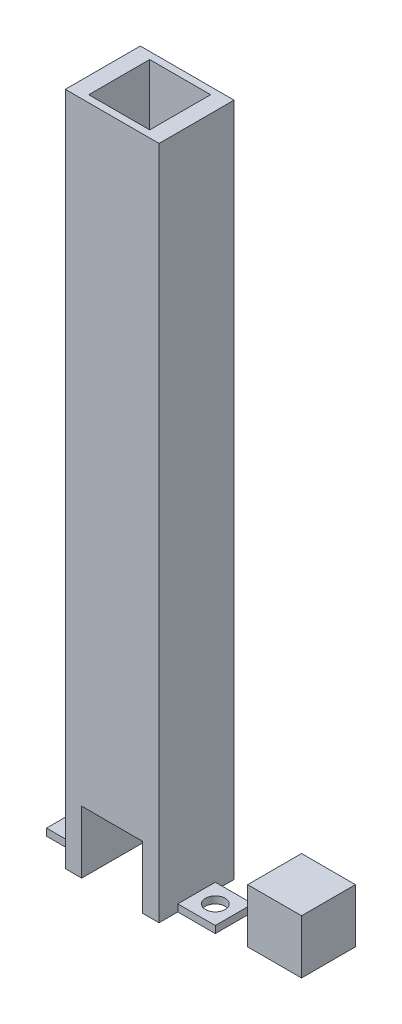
SolidWorks part; units mm, degrees
ref_plane "Front Plane" through (0, 0, 0) normal (0, 0, 1) x (1, 0, 0)
ref_plane "Top Plane" through (0, 0, 0) normal (0, 1, 0) x (1, 0, 0)
ref_plane "Right Plane" through (0, 0, 0) normal (1, 0, 0) x (0, 0, -1)
sketch "Sketch1" plane through (0, 0, 0) normal (0, 0, 1) x (1, 0, 0)
  line L1 (0, 0) -> (-11.5, 0)
  line L2 (0, 0) -> (0, -11.5)
  line L3 (0, -11.5) -> (-11.5, -11.5)
  line L4 (-11.5, 0) -> (-11.5, -11.5)
  dimension "D1" = 11.5
  dimension "D2" = 11.5
extrude "Boss-Extrude1" add sketch "Sketch1" along normal blind 11.5
sketch "Sketch2" plane through (0, 0, 0) normal (0, 0, 1) x (1, 0, 0)
  line L1 (-45.8982, -12) -> (-25.8982, -12)
  line L2 (-45.8982, -12) -> (-45.8982, 132)
  line L3 (-45.8982, 132) -> (-25.8982, 132)
  line L4 (-25.8982, -12) -> (-25.8982, 132)
  dimension "D1" = 20
  dimension "D2" = 144
extrude "Boss-Extrude2" add sketch "Sketch2" along normal blind 16 separate body
sketch "Sketch4" plane through (0, 132, 0) normal (0, 1, 0) x (1, 0, 0)
  line L0 (-25.8982, -16) -> (-25.8982, 0) construction
  line L1 (-42.3982, -1.5) -> (-29.3982, -1.5)
  line L2 (-42.3982, -1.5) -> (-42.3982, -14.5)
  line L3 (-42.3982, -14.5) -> (-29.3982, -14.5)
  line L4 (-29.3982, -1.5) -> (-29.3982, -14.5)
  line L5 (-45.8982, -16) -> (-45.8982, 0) construction
  line L6 (-25.8982, -16) -> (-45.8982, -16) construction
  line L7 (-25.8982, 0) -> (-45.8982, 0) construction
  dimension "D1" = 3.5
  dimension "D2" = 3.5
  dimension "D3" = 1.5
  dimension "D4" = 1.5
extrude "Cut-Extrude1" cut sketch "Sketch4" against normal through all contours L2 L1 L4 L3
sketch "Sketch5" plane through (0, 0, 16) normal (0, 0, 1) x (1, 0, 0)
  line L0 (-25.8982, -12) -> (-25.8982, 132) construction
  line L1 (-29.3982, 1.3) -> (-42.3982, 1.3)
  line L2 (-29.3982, 1.3) -> (-29.3982, -12)
  line L3 (-29.3982, -12) -> (-42.3982, -12)
  line L4 (-42.3982, 1.3) -> (-42.3982, -12)
  line L5 (-45.8982, 132) -> (-45.8982, -12) construction
  line L6 (-45.8982, -12) -> (-25.8982, -12) construction
  dimension "D1" = 3.5
  dimension "D2" = 3.5
  dimension "D3" = 0
  dimension "D4" = 13.3
extrude "Cut-Extrude2" cut sketch "Sketch5" against normal blind 1.5 contours L2 L1 L4 L3
sketch "Sketch6" plane through (0, 0, 0) normal (0, 0, -1) x (-1, 0, 0)
  line L0 (45.8982, -12) -> (25.8982, -12) construction
  line L1 (42.3982, -4) -> (29.3982, -4)
  line L2 (42.3982, -4) -> (42.3982, -12)
  line L3 (42.3982, -12) -> (29.3982, -12)
  line L4 (29.3982, -4) -> (29.3982, -12)
  line L5 (45.8982, 132) -> (45.8982, -12) construction
  line L6 (25.8982, -12) -> (25.8982, 132) construction
  dimension "D1" = 3.5
  dimension "D2" = 3.5
  dimension "D3" = 8
extrude "Cut-Extrude3" cut sketch "Sketch6" against normal blind 1.5 contours L2 L1 L4 L3
sketch "Sketch7" plane through (-45.8982, 0, 0) normal (-1, 0, 0) x (0, 0, 1)
  line L1 (4, -12) -> (12, -12)
  line L2 (4, -12) -> (4, -10.5)
  line L3 (4, -10.5) -> (12, -10.5)
  line L4 (12, -12) -> (12, -10.5)
  line L7 (0, 132) -> (0, -12) construction
  line L8 (16, 132) -> (16, -12) construction
  dimension "D1" = 1.5
  dimension "D2" = 4
  dimension "D3" = 4
  dimension "D4" = 8
extrude "Boss-Extrude3" add sketch "Sketch7" along normal blind 8
sketch "Sketch8" plane through (0, -10.5, 0) normal (0, 1, 0) x (1, 0, 0)
  line L0 (-53.8982, -12) -> (-53.8982, -4) construction
  line L1 (-53.8982, -4) -> (-45.8982, -4) construction
  circle A0 centre (-49.8982, -8) radius 2.1
  dimension "D1" = 4.2
  dimension "D2" = 4
  dimension "D3" = 4
extrude "Cut-Extrude4" cut sketch "Sketch8" against normal blind 10 contours A0
sketch "Sketch9" plane through (0, 0, 16) normal (0, 0, 1) x (1, 0, 0)
  line L0 (-35.8982, 132) -> (-35.8982, -17.9231) construction
  line L1 (-25.8982, 132) -> (-45.8982, 132) construction
ref_plane "Plane1" through (-35.8982, 0, 0) normal (-1, 0, 0) x (0, 0, 1)
mirror "Mirror3" about plane through (-35.8982, 0, 0) normal (-1, 0, 0) of "Cut-Extrude4", "Boss-Extrude3"
